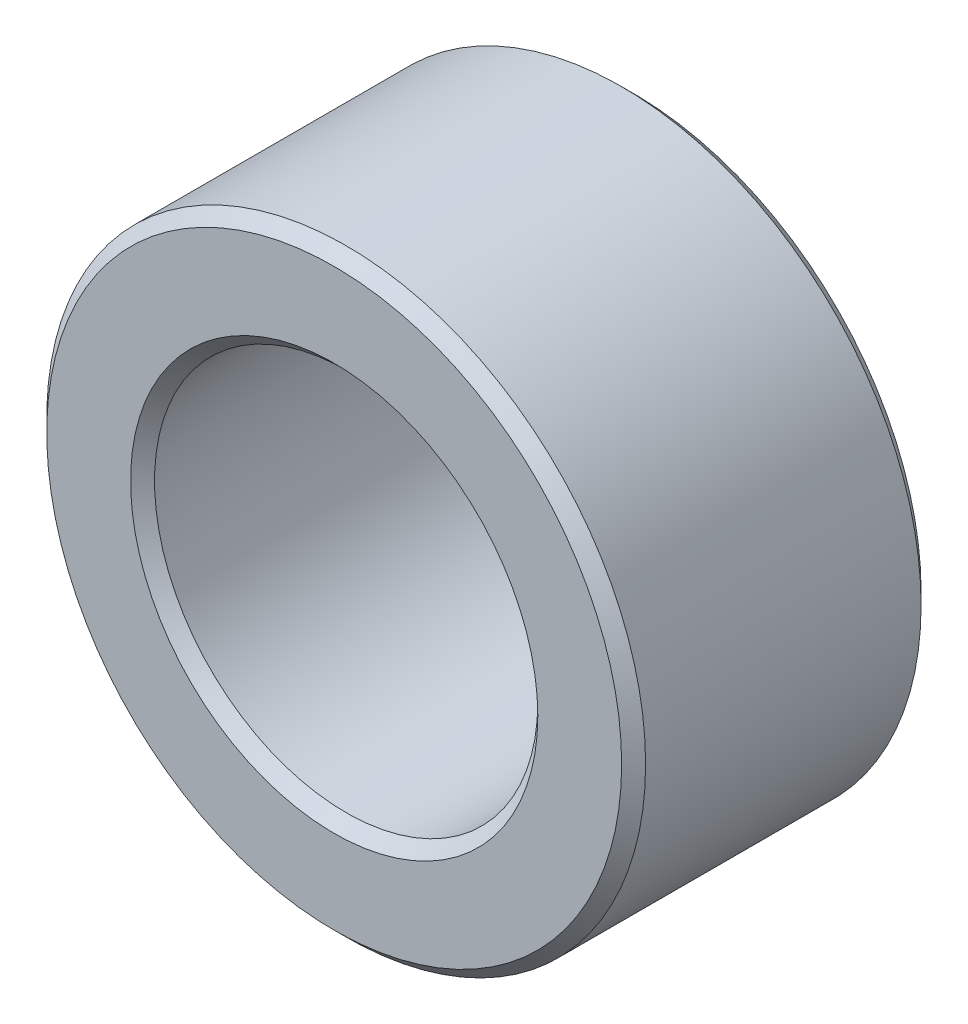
SolidWorks part; units mm, degrees
ref_plane "Front Plane" through (0, 0, 0) normal (0, 0, 1) x (1, 0, 0)
ref_plane "Top Plane" through (0, 0, 0) normal (0, 1, 0) x (1, 0, 0)
ref_plane "Right Plane" through (0, 0, 0) normal (1, 0, 0) x (0, 0, -1)
sketch "Sketch1" plane through (0, 0, 0) normal (0, 0, 1) x (1, 0, 0)
  circle A0 centre (0, 0) radius 5
  circle A1 centre (0, 0) radius 3.2
  dimension "D1" = 10
  dimension "D2" = 6.4
extrude "Boss-Extrude2" add sketch "Sketch1" along normal mid plane 5
chamfer "Chamfer3" distance 0.2 angle 45 4 edges at (5, 0, 2.5) (5, 0, -2.5) (3.2, 0, -2.5) (3.2, 0, 2.5)
